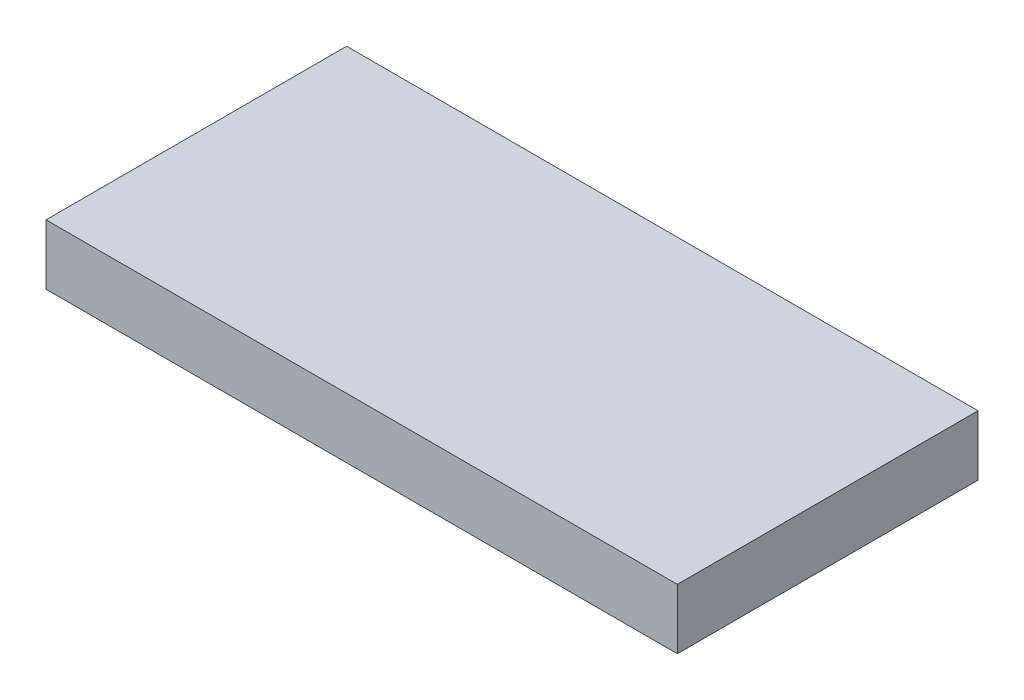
SolidWorks part; units mm, degrees
ref_plane "Front Plane" through (0, 0, 0) normal (0, 0, 1) x (1, 0, 0)
ref_plane "Top Plane" through (0, 0, 0) normal (0, 1, 0) x (1, 0, 0)
ref_plane "Right Plane" through (0, 0, 0) normal (1, 0, 0) x (0, 0, -1)
sketch "Sketch1" plane through (0, 0, 0) normal (0, 1, 0) x (1, 0, 0)
  line L1 (-34.29, -10.16) -> (19.05, -10.16)
  line L2 (-34.29, -10.16) -> (-34.29, 15.24)
  line L3 (-34.29, 15.24) -> (19.05, 15.24)
  line L4 (19.05, -10.16) -> (19.05, 15.24)
  dimension "D1" = 53.34
  dimension "D2" = 25.4
  dimension "D3" = 10.16
  dimension "D4" = 19.05
extrude "Boss-Extrude1" add sketch "Sketch1" along normal blind 5.08
